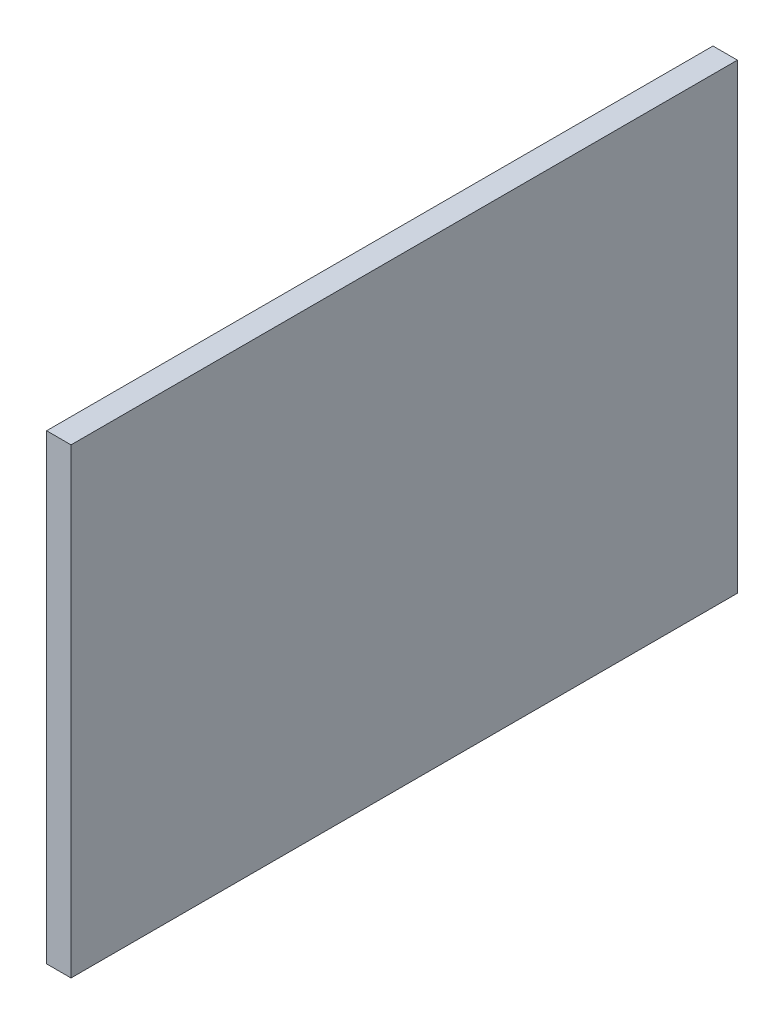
SolidWorks part; units mm, degrees
ref_plane "Plano frontal" through (0, 0, 0) normal (0, 0, 1) x (1, 0, 0)
ref_plane "Plano superior" through (0, 0, 0) normal (0, 1, 0) x (1, 0, 0)
ref_plane "Plano direito" through (0, 0, 0) normal (1, 0, 0) x (0, 0, -1)
sketch "Esboço2" plane through (0, 0, 0) normal (0, 0, 1) x (1, 0, 0)
  line L0 (263, -18) -> (263, 49982) construction
  line L1 (281, -18) -> (281, 49982) construction
  line L2 (-719, 987) -> (49281, 987) construction
  line L3 (-719.0211, 647.5) -> (49280.9789, 647.5) construction
  line L5 (263, 987) -> (280.9789, 987)
  line L6 (263, 987) -> (263, 647.5)
  line L7 (263, 647.5) -> (280.9789, 647.5)
  line L8 (280.9789, 987) -> (280.9789, 647.5)
extrude "Ressalto-extrusão1" add sketch "Esboço2" against normal blind 490
